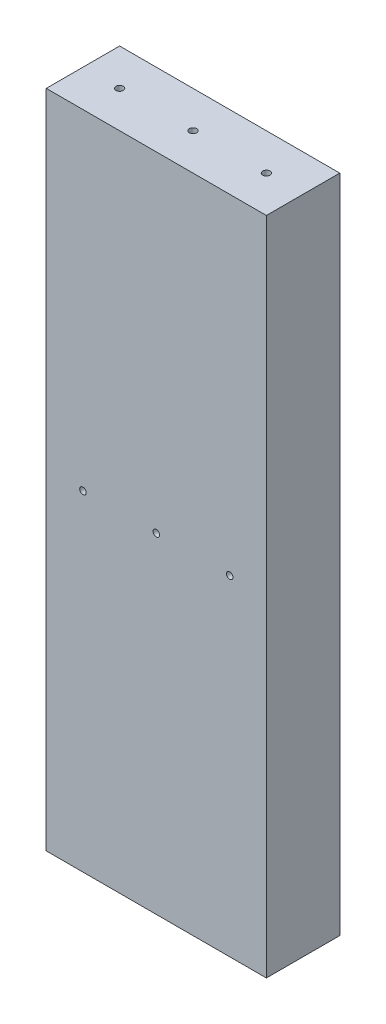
SolidWorks part; units mm, degrees
ref_plane "Front Plane" through (0, 0, 0) normal (0, 0, 1) x (1, 0, 0)
ref_plane "Top Plane" through (0, 0, 0) normal (0, 1, 0) x (1, 0, 0)
ref_plane "Right Plane" through (0, 0, 0) normal (1, 0, 0) x (0, 0, -1)
sketch "Sketch1" plane through (0, 0, 0) normal (0, 1, 0) x (1, 0, 0)
  line L1 (-76.2, 25.4) -> (76.2, 25.4)
  line L2 (-76.2, 25.4) -> (-76.2, -25.4)
  line L3 (-76.2, -25.4) -> (76.2, -25.4)
  line L4 (76.2, 25.4) -> (76.2, -25.4)
  line L5 (-76.2, 25.4) -> (76.2, -25.4) construction
  line L6 (-76.2, -25.4) -> (76.2, 25.4) construction
  point P0 (0, 0)
  dimension "D1" = 152.4
  dimension "D2" = 50.8
extrude "Boss-Extrude1" add sketch "Sketch1" along normal blind 457.2
hole_wizard "CSK for #8 Flat Head Machine Screw (100)2" positions "Sketch5" profile "Sketch4" countersink size "#8" standard "ANSI Inch"
sketch "Sketch5" plane through (0, 0, -25.4) normal (0, 0, -1) x (-1, 0, 0)
  line L0 (0, 457.2) -> (0, 0) construction
  line L1 (-76.2, 457.2) -> (76.2, 457.2) construction
  line L2 (-76.2, 0) -> (76.2, 0) construction
  line L4 (76.2, 228.6) -> (-76.2, 228.6) construction
  line L5 (76.2, 457.2) -> (76.2, 0) construction
  line L6 (-76.2, 457.2) -> (-76.2, 0) construction
  point P0 (50.8, 228.6)
  point P2 (0, 228.6)
  point P4 (-50.8, 228.6)
  dimension "D1" = 25.4
  dimension "D2" = 25.4
sketch "Sketch4" plane through (-50.8, 228.6, -25.4) normal (1, 0, 0) x (0, 1, 0)
  line L0 (0, 0) -> (0, 50.8)
  line L1 (0, 50.8) -> (2.2479, 50.8)
  line L2 (2.2479, 50.8) -> (2.2479, 1.6518)
  line L3 (2.2479, 1.6518) -> (4.2164, 0)
  line L5 (4.2164, 0) -> (0, 0)
  line L6 (-2.2479, 1.6518) -> (-4.2164, 0) construction
  line L11 (0, -6.35) -> (0, 107.95) construction
  dimension "Thru Hole Dia." = 4.4958
  dimension "Thru Hole Depth" = 50.8
  dimension "Near C'Sink Dia." = 8.4328
  dimension "Near C'Sink Angle" = 100
sketch "Sketch6" [suppressed] plane through (0, 457.2, 0) normal (0, 1, 0) x (1, 0, 0)
  line L0 (69.85, -19.05) -> (63.1319, 19.05)
  line L5 (69.85, 19.05) -> (-69.85, 19.05) construction
  line L6 (69.85, 19.05) -> (69.85, -19.05)
  line L7 (63.1319, 19.05) -> (69.85, 19.05)
  dimension "D1" = 10
extrude "Cut-Extrude2" [suppressed] cut sketch "Sketch6" against normal through all
sketch "Sketch7" plane through (0, 0, 457.2) normal (0, -1, 0) x (-1, 0, 0)
  line L0 (0, 2362.2) -> (0, 0) construction
  line L4 (50.8, 2362.2) -> (50.8, 0) construction
  line L6 (-50.8, 0) -> (-50.8, 2362.2) construction
  line L10 (76.2, 1905) -> (-76.2, 1905) construction
  line L12 (76.2, 1422.4) -> (-76.2, 1422.4) construction
  line L14 (76.2, 939.8) -> (-76.2, 939.8) construction
  line L16 (76.2, 457.2) -> (-76.2, 457.2) construction
  point P0 (50.8, 1905)
  point P2 (0, 1905)
  point P4 (-50.8, 1905)
  point P6 (50.8, 1422.4)
  point P8 (0, 1422.4)
  point P10 (-50.8, 1422.4)
  point P12 (50.8, 939.8)
  point P14 (0, 939.8)
  point P16 (-50.8, 939.8)
  point P18 (50.8, 457.2)
  point P20 (0, 457.2)
  point P22 (-50.8, 457.2)
sketch "Sketch8" plane through (0, 0, 0) normal (0, -1, 0) x (1, 0, 0)
  point P0 (50.8, 0)
  point P2 (0, 0)
  point P4 (-50.8, 0)
hole_wizard "#8 (0.199) Diameter Hole1" positions "Sketch9" profile "Sketch10" hole size "#8" standard "ANSI Inch"
sketch "Sketch9" plane through (0, 0, 0) normal (0, -1, 0) x (-1, 0, 0)
  point P0 (-50.8, 0)
  point P3 (0, 0)
  point P6 (50.8, 0)
sketch "Sketch10" plane through (50.8, 0, 0) normal (1, 0, 0) x (0, 0, -1)
  line L0 (0, 0) -> (0, 26.9186)
  line L1 (0, 26.9186) -> (2.5273, 25.4)
  line L2 (2.5273, 25.4) -> (2.5273, 0)
  line L5 (2.5273, 0) -> (0, 0)
  line L10 (0, 26.9186) -> (-2.5273, 25.4) construction
  line L11 (0, -6.35) -> (0, 107.95) construction
  dimension "Hole Dia." = 5.0546
  dimension "Hole Depth" = 25.4
  dimension "Drill Angle" = 118
sketch "Sketch11" plane through (0, 457.2, 0) normal (0, 1, 0) x (1, 0, 0)
  point P0 (50.8, 0)
  point P2 (0, 0)
  point P4 (-50.8, 0)
hole_wizard "#8 (0.199) Diameter Hole2" positions "Sketch12" profile "Sketch13" hole size "#8" standard "ANSI Inch"
sketch "Sketch12" plane through (0, 457.2, 0) normal (0, 1, 0) x (1, 0, 0)
  point P0 (-50.8, 0)
  point P3 (0, 0)
  point P6 (50.8, 0)
sketch "Sketch13" plane through (-50.8, 457.2, 0) normal (1, 0, 0) x (0, 0, 1)
  line L0 (0, 0) -> (0, 26.9186)
  line L1 (0, 26.9186) -> (2.5273, 25.4)
  line L2 (2.5273, 25.4) -> (2.5273, 0)
  line L5 (2.5273, 0) -> (0, 0)
  line L10 (0, 26.9186) -> (-2.5273, 25.4) construction
  line L11 (0, -6.35) -> (0, 107.95) construction
  dimension "Hole Dia." = 5.0546
  dimension "Hole Depth" = 25.4
  dimension "Drill Angle" = 118
